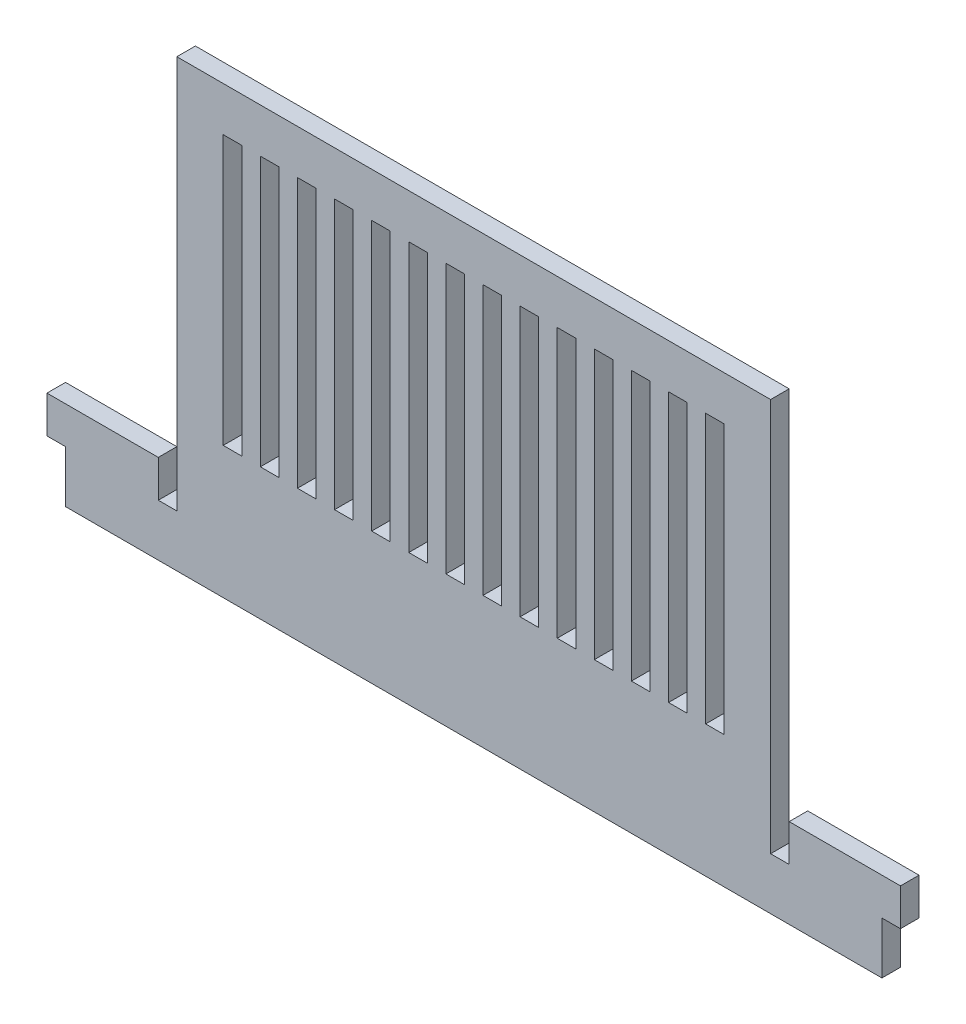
SolidWorks part; units mm, degrees
ref_plane "Front Plane" through (0, 0, 0) normal (0, 0, 1) x (1, 0, 0)
ref_plane "Top Plane" through (0, 0, 0) normal (0, 1, 0) x (1, 0, 0)
ref_plane "Right Plane" through (0, 0, 0) normal (1, 0, 0) x (0, 0, -1)
sketch "Sketch1" plane through (0, 0, 0) normal (0, 0, 1) x (1, 0, 0)
  line L0 (-142.875, -7.62) -> (-3.175, -7.62)
  line L1 (-3.175, -7.62) -> (-3.175, 1.27)
  line L2 (-3.175, 1.27) -> (0, 1.27)
  line L3 (0, 1.27) -> (0, 7.62)
  line L4 (-142.875, -7.62) -> (-142.875, 1.27)
  line L5 (-142.875, 1.27) -> (-146.05, 1.27)
  line L6 (-146.05, 1.27) -> (-146.05, 7.62)
  line L7 (-71.4375, 14.9491) -> (-71.4375, 60.9992)
  line L8 (0, 7.62) -> (-19.05, 7.62)
  line L9 (-73.025, -7.62) -> (-73.025, 68.58) construction
  line L10 (-123.825, 68.58) -> (-22.225, 68.58)
  line L11 (-19.05, 1.27) -> (-19.05, 7.62)
  line L12 (-22.225, 1.27) -> (-22.225, 68.58)
  line L13 (-127, 1.27) -> (-123.825, 1.27)
  line L14 (-127, 1.27) -> (-127, 7.62)
  line L15 (-146.05, 7.62) -> (-127, 7.62)
  line L16 (-22.225, -7.62) -> (-22.225, 68.58) construction
  line L17 (-19.05, -7.62) -> (-19.05, 68.58) construction
  line L18 (-19.05, 1.27) -> (-22.225, 1.27)
  line L19 (-123.825, 1.27) -> (-123.825, 68.58)
  line L20 (-68.2625, 14.9491) -> (-68.2625, 60.9992)
  line L21 (-65.0875, 14.9491) -> (-65.0875, 60.9992)
  line L22 (-61.9125, 14.9491) -> (-61.9125, 60.9992)
  line L23 (-58.7375, 14.9491) -> (-58.7375, 60.9992)
  line L24 (-55.5625, 14.9491) -> (-55.5625, 60.9992)
  line L25 (-52.3875, 14.9491) -> (-52.3875, 60.9992)
  line L26 (-49.2125, 14.9491) -> (-49.2125, 60.9992)
  line L27 (-46.0375, 14.9491) -> (-46.0375, 60.9992)
  line L28 (-42.8625, 14.9491) -> (-42.8625, 60.9992)
  line L29 (-39.6875, 14.9491) -> (-39.6875, 60.9992)
  line L30 (-36.5125, 14.9491) -> (-36.5125, 60.9992)
  line L31 (-33.3375, 14.9491) -> (-33.3375, 60.9992)
  line L32 (-30.1625, 14.9491) -> (-30.1625, 60.9992)
  line L33 (-71.4375, 14.9491) -> (-68.2625, 14.9491)
  line L34 (-71.4375, -7.62) -> (-71.4375, 68.58) construction
  line L35 (-71.4375, 60.9992) -> (-68.2625, 60.9992)
  line L36 (-65.0875, 60.9992) -> (-61.9125, 60.9992)
  line L37 (-65.0875, 14.9491) -> (-61.9125, 14.9491)
  line L38 (-58.7375, 60.9992) -> (-55.5625, 60.9992)
  line L39 (-58.7375, 14.9491) -> (-55.5625, 14.9491)
  line L40 (-52.3875, 60.9992) -> (-49.2125, 60.9992)
  line L41 (-46.0375, 60.9992) -> (-42.8625, 60.9992)
  line L42 (-39.6875, 60.9992) -> (-36.5125, 60.9992)
  line L43 (-33.3375, 60.9992) -> (-30.1625, 60.9992)
  line L44 (-52.3875, 14.9491) -> (-49.2125, 14.9491)
  line L45 (-46.0375, 14.9491) -> (-42.8625, 14.9491)
  line L46 (-39.6875, 14.9491) -> (-36.5125, 14.9491)
  line L47 (-33.3375, 14.9491) -> (-30.1625, 14.9491)
  line L48 (-112.7125, 14.9491) -> (-115.8875, 14.9491)
  line L49 (-106.3625, 14.9491) -> (-109.5375, 14.9491)
  line L50 (-100.0125, 14.9491) -> (-103.1875, 14.9491)
  line L51 (-93.6625, 14.9491) -> (-96.8375, 14.9491)
  line L52 (-112.7125, 60.9992) -> (-115.8875, 60.9992)
  line L53 (-106.3625, 60.9992) -> (-109.5375, 60.9992)
  line L54 (-100.0125, 60.9992) -> (-103.1875, 60.9992)
  line L55 (-93.6625, 60.9992) -> (-96.8375, 60.9992)
  line L56 (-87.3125, 14.9491) -> (-90.4875, 14.9491)
  line L57 (-87.3125, 60.9992) -> (-90.4875, 60.9992)
  line L58 (-80.9625, 14.9491) -> (-84.1375, 14.9491)
  line L59 (-80.9625, 60.9992) -> (-84.1375, 60.9992)
  line L60 (-74.6125, 60.9992) -> (-77.7875, 60.9992)
  line L61 (-74.6125, 14.9491) -> (-77.7875, 14.9491)
  line L62 (-115.8875, 14.9491) -> (-115.8875, 60.9992)
  line L63 (-112.7125, 14.9491) -> (-112.7125, 60.9992)
  line L64 (-109.5375, 14.9491) -> (-109.5375, 60.9992)
  line L65 (-106.3625, 14.9491) -> (-106.3625, 60.9992)
  line L66 (-103.1875, 14.9491) -> (-103.1875, 60.9992)
  line L67 (-100.0125, 14.9491) -> (-100.0125, 60.9992)
  line L68 (-96.8375, 14.9491) -> (-96.8375, 60.9992)
  line L69 (-93.6625, 14.9491) -> (-93.6625, 60.9992)
  line L70 (-90.4875, 14.9491) -> (-90.4875, 60.9992)
  line L71 (-87.3125, 14.9491) -> (-87.3125, 60.9992)
  line L72 (-84.1375, 14.9491) -> (-84.1375, 60.9992)
  line L73 (-80.9625, 14.9491) -> (-80.9625, 60.9992)
  line L74 (-77.7875, 14.9491) -> (-77.7875, 60.9992)
  line L75 (-74.6125, 14.9491) -> (-74.6125, 60.9992)
  dimension "D1" = 50.8
  dimension "D2" = 3.175
  dimension "D3" = 1.5875
  dimension "D4" = 14
extrude "Boss-Extrude1" add sketch "Sketch1" along normal blind 3.175
